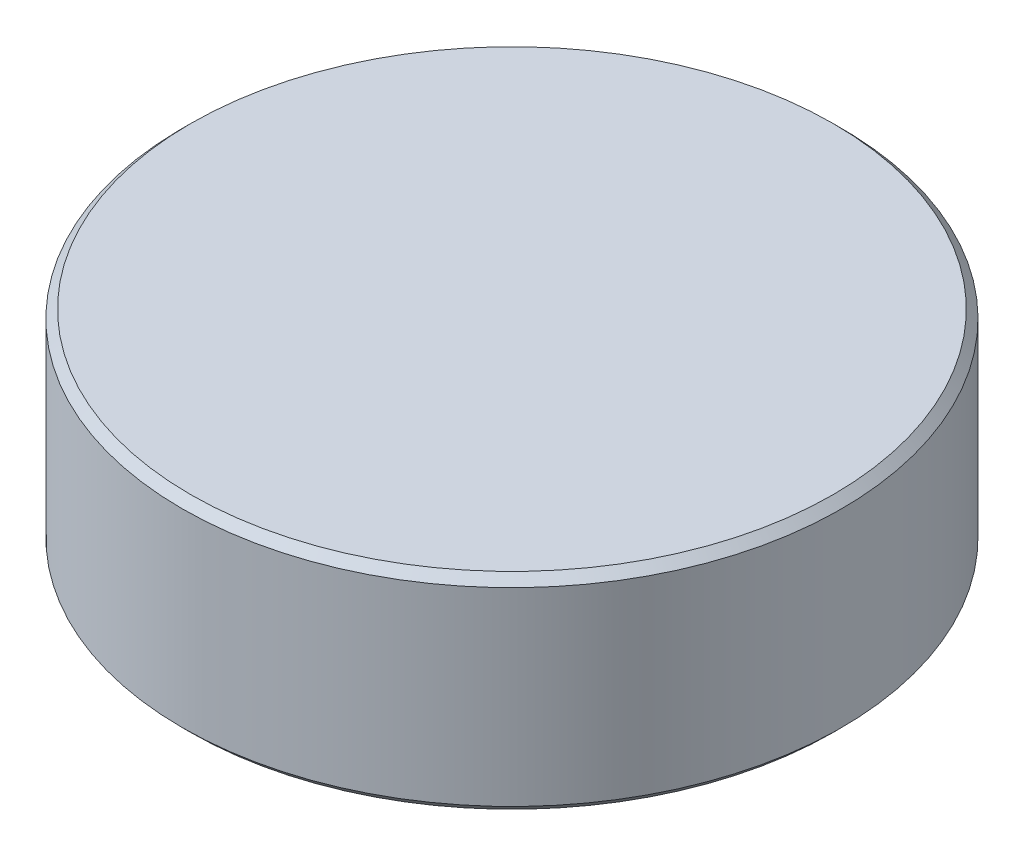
SolidWorks part; units mm, degrees
ref_plane "Front Plane" through (0, 0, 0) normal (0, 0, 1) x (1, 0, 0)
ref_plane "Top Plane" through (0, 0, 0) normal (0, 1, 0) x (1, 0, 0)
ref_plane "Right Plane" through (0, 0, 0) normal (1, 0, 0) x (0, 0, -1)
sketch "Sketch1" plane through (0, 0, 0) normal (0, 1, 0) x (1, 0, 0)
  circle A0 centre (0, 0) radius 50.8
extrude "Extrude1" add sketch "Sketch1" along normal blind 31.75
chamfer "Chamfer1" distance 1.27 angle 45 2 edges at (0, 0, 50.8) (0, 31.75, 50.8)
